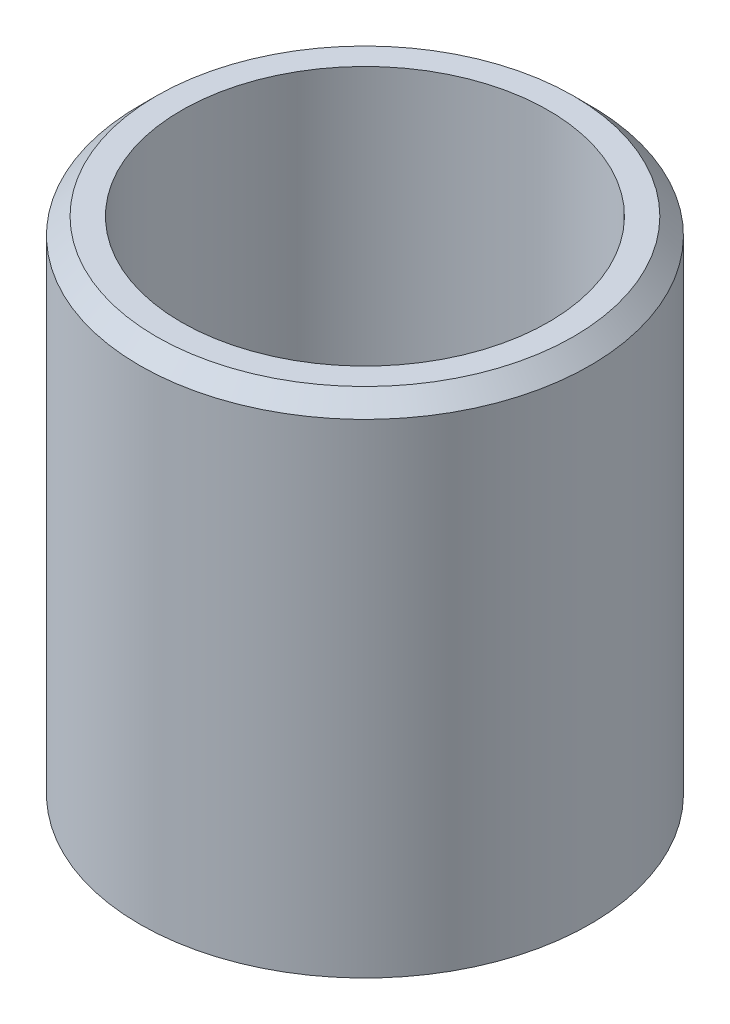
SolidWorks part; units mm, degrees
ref_plane "Plan de face" through (0, 0, 0) normal (0, 0, 1) x (1, 0, 0)
ref_plane "Plan de dessus" through (0, 0, 0) normal (0, 1, 0) x (1, 0, 0)
ref_plane "Plan de droite" through (0, 0, 0) normal (1, 0, 0) x (0, 0, -1)
sketch "Esquisse1" plane through (0, 0, 0) normal (0, 1, 0) x (1, 0, 0)
  circle A0 centre (0, 0) radius 11
  circle A1 centre (0, 0) radius 13.5
  dimension "D1" = 22
  dimension "D2" = 27
extrude "Extrusion1" add sketch "Esquisse1" along normal blind 30
chamfer "Chanfrein1" distance 1 angle 45 1 edges at (0, 30, 13.5)
